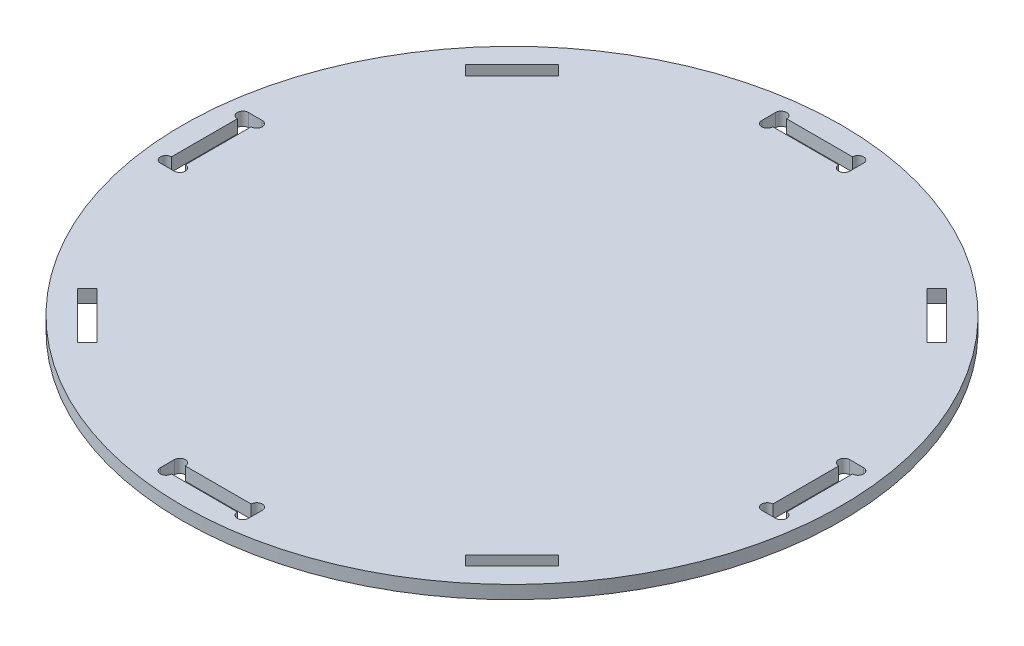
SolidWorks part; units mm, degrees
ref_plane "Front" through (0, 0, 0) normal (0, 0, 1) x (1, 0, 0)
ref_plane "Top" through (0, 0, 0) normal (0, 1, 0) x (1, 0, 0)
ref_plane "Right" through (0, 0, 0) normal (1, 0, 0) x (0, 0, -1)
sketch "Sketch1" plane through (0, 0, 0) normal (0, 1, 0) x (1, 0, 0)
  circle A0 centre (0, 0) radius 300
  dimension "D1" = 600
extrude "Boss-Extrude2" add sketch "Sketch1" along normal blind 12 contours A0
sketch "Sketch3" plane through (0, 12, 0) normal (0, 1, 0) x (1, 0, 0)
  line L0 (0, 300) -> (0, -300) construction
  line L1 (-300, 0) -> (300, 0) construction
  line L2 (-30, 280) -> (30, 280)
  line L3 (-30, 273.7) -> (30, 273.7) construction
  line L4 (-30, 267.4) -> (30, 267.4)
  line L5 (-39.9996, 280) -> (-39.9996, 267.4)
  line L6 (39.9996, 280) -> (39.9996, 267.4)
  line L7 (280, 39.9996) -> (267.4, 39.9996)
  line L8 (280, 30) -> (280, -30)
  line L9 (267.4, 30) -> (267.4, -30)
  line L10 (280, -39.9996) -> (267.4, -39.9996)
  line L11 (39.9996, -280) -> (39.9996, -267.4)
  line L12 (30, -280) -> (-30, -280)
  line L13 (30, -267.4) -> (-30, -267.4)
  line L14 (-39.9996, -280) -> (-39.9996, -267.4)
  line L15 (-280, -39.9996) -> (-267.4, -39.9996)
  line L16 (-280, -30) -> (-280, 30)
  line L17 (-267.4, -30) -> (-267.4, 30)
  line L18 (-280, 39.9996) -> (-267.4, 39.9996)
  circle A0 centre (0, 0) radius 300 construction
  arc A1 (280, 30) -> (280, 39.9996) centre (280.044, 34.9998) ccw
  arc A2 (-30, 280) -> (-39.9996, 280) centre (-34.9998, 280.044) ccw
  arc A3 (-30, 267.4) -> (-39.9996, 267.4) centre (-34.9998, 267.356) cw
  arc A4 (30, 267.4) -> (39.9996, 267.4) centre (34.9998, 267.356) ccw
  arc A7 (30, 280) -> (39.9996, 280) centre (34.9998, 280.044) cw
  arc A8 (267.4, 30) -> (267.4, 39.9996) centre (267.356, 34.9998) cw
  arc A9 (280, -30) -> (280, -39.9996) centre (280.044, -34.9998) cw
  arc A10 (267.4, -30) -> (267.4, -39.9996) centre (267.356, -34.9998) ccw
  arc A11 (30, -280) -> (39.9996, -280) centre (34.9998, -280.044) ccw
  arc A12 (30, -267.4) -> (39.9996, -267.4) centre (34.9998, -267.356) cw
  arc A13 (-30, -280) -> (-39.9996, -280) centre (-34.9998, -280.044) cw
  arc A14 (-30, -267.4) -> (-39.9996, -267.4) centre (-34.9998, -267.356) ccw
  arc A15 (-280, -30) -> (-280, -39.9996) centre (-280.044, -34.9998) ccw
  arc A16 (-267.4, -30) -> (-267.4, -39.9996) centre (-267.356, -34.9998) cw
  arc A17 (-280, 30) -> (-280, 39.9996) centre (-280.044, 34.9998) cw
  arc A18 (-267.4, 30) -> (-267.4, 39.9996) centre (-267.356, 34.9998) ccw
  point P12 (0, 280)
  point P64 (0, 0)
  dimension "D4" = 5
  dimension "D1" = 60
  dimension "D3" = 6.3
  dimension "D5" = 4
extrude "Cut-Extrude1" cut sketch "Sketch3" against normal through all
sketch "Sketch4" plane through (0, 12, 0) normal (0, 1, 0) x (1, 0, 0)
  line L0 (0, 300) -> (0, -300) construction
  line L1 (-300, 0) -> (300, 0) construction
  line L2 (-212.132, 212.132) -> (212.132, -212.132) construction
  line L3 (212.132, 212.132) -> (-212.132, -212.132) construction
  line L4 (-218.9264, 176.5) -> (-176.5, 218.9264)
  line L5 (-176.5, 218.9264) -> (-167.6612, 210.0876)
  line L6 (-167.6612, 210.0876) -> (-210.0876, 167.6612)
  line L7 (-210.0876, 167.6612) -> (-218.9264, 176.5)
  line L8 (176.5, 218.9264) -> (218.9264, 176.5)
  line L9 (218.9264, 176.5) -> (210.0876, 167.6612)
  line L10 (167.6612, 210.0876) -> (176.5, 218.9264)
  line L11 (210.0876, 167.6612) -> (167.6612, 210.0876)
  line L12 (218.9264, -176.5) -> (176.5, -218.9264)
  line L13 (176.5, -218.9264) -> (167.6612, -210.0876)
  line L14 (210.0876, -167.6612) -> (218.9264, -176.5)
  line L15 (167.6612, -210.0876) -> (210.0876, -167.6612)
  line L16 (-176.5, -218.9264) -> (-218.9264, -176.5)
  line L17 (-218.9264, -176.5) -> (-210.0876, -167.6612)
  line L18 (-167.6612, -210.0876) -> (-176.5, -218.9264)
  line L19 (-210.0876, -167.6612) -> (-167.6612, -210.0876)
  circle A0 centre (0, 0) radius 300 construction
  circle A4 centre (0, 0) radius 275
  circle A5 centre (0, 0) radius 275 construction
  point P16 (-197.7132, -197.7132)
  point P19 (-172.0806, -214.507)
  point P20 (172.0806, -214.507)
  point P33 (0, 0)
  point P34 (-172.0806, 214.507)
  dimension "D1" = 45
  dimension "D3" = 45
  dimension "D4" = 60
  dimension "D6" = 12.5
  dimension "D2" = 25
  dimension "D5" = 4
extrude "Cut-Extrude2" cut sketch "Sketch4" against normal through all
